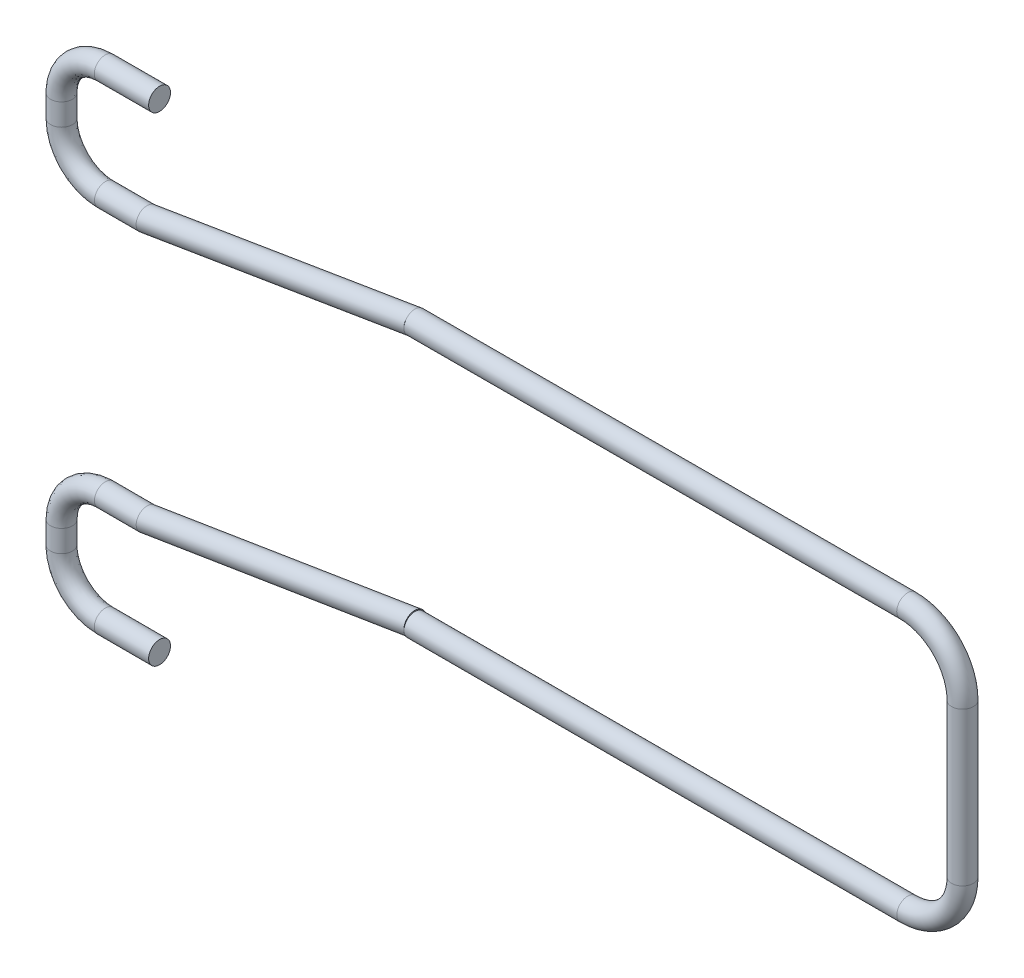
SolidWorks part; units mm, degrees
ref_plane "Face" through (0, 0, 0) normal (0, 0, 1) x (1, 0, 0)
ref_plane "Dessus" through (0, 0, 0) normal (0, 1, 0) x (1, 0, 0)
ref_plane "Droite" through (0, 0, 0) normal (1, 0, 0) x (0, 0, -1)
ref_plane "Plan1" through (0, 0, 0.5) normal (0, 0, 1) x (1, 0, 0)
sketch "Esquisse2" plane through (0, 0, 0.5) normal (0, 0, 1) x (1, 0, 0)
  line L0 (-4, 3.4896) -> (-4, -3.5)
  line L1 (-6.5, -6) -> (-29, -6)
  line L2 (-6.504, 5.9896) -> (-29, 5.9536)
  arc A0 (-4, 3.4896) -> (-6.504, 5.9896) centre (-6.5, 3.4896) ccw
  arc A1 (-6.5, -6) -> (-4, -3.5) centre (-6.5, -3.5) ccw
  point P7 (-4, 5.9936)
  point P10 (-4, -6)
  dimension "D6" = 2.5
  dimension "D1" = 6
  dimension "D2" = 6
  dimension "D3" = 25
  dimension "D4" = 25
  dimension "D5" = 4
ref_plane "Plan2" through (-29, 0, 0) normal (1, 0, 0) x (0, 0, -1)
ref_plane "Plan3" through (0, 0, 2.5) normal (0, 0, 1) x (1, 0, 0)
sketch "Esquisse4" plane through (0, 0, 2.5) normal (0, 0, 1) x (1, 0, 0)
  line L0 (-38.6568, 10.9382) -> (-41.1376, 10.9342)
  line L1 (-43.1344, 8.931) -> (-43.1328, 7.931)
  line L2 (-41.1296, 5.9342) -> (-39.2243, 5.9373)
  line L3 (-6.504, 5.9896) -> (-29, 5.9536) construction
  arc A0 (-43.1344, 8.931) -> (-41.1376, 10.9342) centre (-41.1344, 8.9342) cw
  arc A1 (-41.1296, 5.9342) -> (-43.1328, 7.931) centre (-41.1328, 7.9342) cw
  dimension "D1" = 2
  dimension "D2" = 5
ref_plane "Plan5" through (-0.0096, 6, 0) normal (-0.0016, 1, 0) x (-1, -0.0016, 0)
sketch "Esquisse6" plane through (-0.0096, 6, 0) normal (-0.0016, 1, 0) x (-1, -0.0016, 0)
  line L0 (39.2147, 2.5) -> (28.9904, 0.5)
sketch "Esquisse7" plane through (-29, 0, 0) normal (1, 0, 0) x (0, 0, -1)
  circle A0 centre (-0.5, -6) radius 0.5
  dimension "D1" = 1
sweep "Balayage2" add profiles "Esquisse7" path "Esquisse2"
sketch "Esquisse8" plane through (-29, 0, 0) normal (1, 0, 0) x (0, 0, -1)
  line L1 (-2.5, 5.9373) -> (-0.5, 5.9536) construction
  circle A0 centre (-0.5041, 5.9536) radius 0.5
ref_plane "Plan6" through (-38.6568, 0, 0) normal (1, 0, 0) x (0, 0, -1)
sketch "Esquisse9" plane through (-38.6568, 0, 0) normal (1, 0, 0) x (0, 0, -1)
  circle A0 centre (-2.5, 10.9382) radius 0.5
  dimension "D1" = 1
sweep "Balayage4" add profiles "Esquisse9" path "Esquisse4"
sweep "Balayage5" add profiles "Esquisse8" path "Esquisse6"
mirror "Symétrie1" about plane through (0, 0, 0) normal (0, 1, 0)
mirror "Symétrie2" about plane through (0, 0, 0) normal (0, 1, 0)
